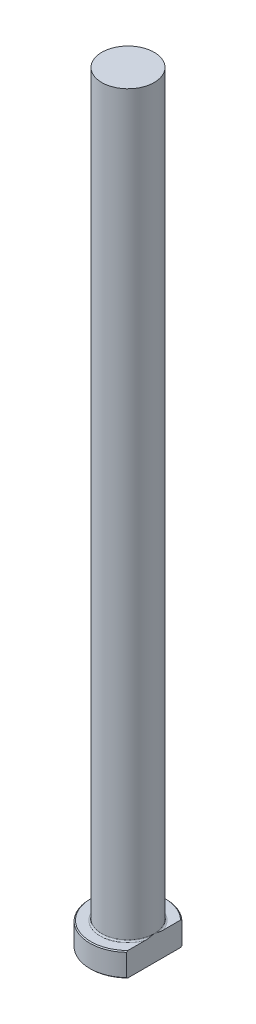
SolidWorks part; units mm, degrees
ref_plane "Front Plane" through (0, 0, 0) normal (0, 0, 1) x (1, 0, 0)
ref_plane "Top Plane" through (0, 0, 0) normal (0, 1, 0) x (1, 0, 0)
ref_plane "Right Plane" through (0, 0, 0) normal (1, 0, 0) x (0, 0, -1)
sketch "Sketch1" plane through (0, 0, 0) normal (0, 0, 1) x (1, 0, 0)
  line L0 (0, 259.9588) -> (0, -15.1925) construction
  line L1 (0, 0) -> (-8, 0)
  line L2 (-8, 0) -> (-8, 5)
  line L3 (-8, 5) -> (-5.5, 5)
  line L4 (-5.5, 5) -> (-5.5, 160)
  line L5 (-5.5, 160) -> (0, 160)
  line L6 (0, 160) -> (0, 0)
  dimension "L" = 160
  dimension "H" = 16
  dimension "T" = 5
  dimension "D" = 11
revolve "Revolve1" add sketch "Sketch1" angle 360 about L0
chamfer "Chamfer1" distance 0.2 angle 45 2 edges at (0, 5, 8) (0, 0, 8)
fillet "Fillet1" radius 0.3 1 edges at (0, 5, 5.5)
sketch "Sketch2" plane through (0, 0, 0) normal (0, 1, 0) x (1, 0, 0)
  line L0 (5.5, 5.8095) -> (5.5, -5.8095)
  circle A0 centre (0, 0) radius 8 construction
  arc A1 (5.5, -5.8095) -> (5.5, 5.8095) centre (0, 0) ccw
  circle A2 centre (0, 0) radius 5.5 construction
extrude "KEY" cut sketch "Sketch2" along normal through all
